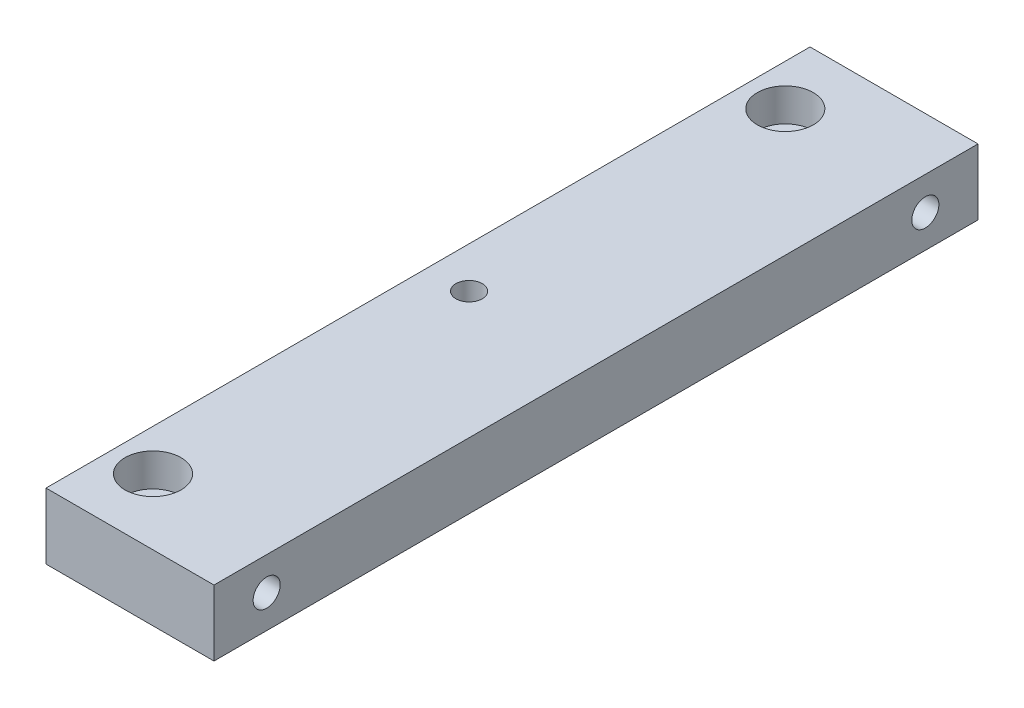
SolidWorks part; units mm, degrees
ref_plane "Front Plane" through (0, 0, 0) normal (0, 0, 1) x (1, 0, 0)
ref_plane "Top Plane" through (0, 0, 0) normal (0, 1, 0) x (1, 0, 0)
ref_plane "Right Plane" through (0, 0, 0) normal (1, 0, 0) x (0, 0, -1)
sketch "Sketch1" plane through (0, 0, 0) normal (0, 1, 0) x (1, 0, 0)
  line L1 (-20.2438, 92.075) -> (20.2438, 92.075)
  line L2 (-20.2438, 92.075) -> (-20.2438, -92.075)
  line L3 (-20.2438, -92.075) -> (20.2438, -92.075)
  line L4 (20.2438, 92.075) -> (20.2438, -92.075)
  line L5 (-20.2438, 92.075) -> (20.2438, -92.075) construction
  line L6 (-20.2438, -92.075) -> (20.2438, 92.075) construction
  point P0 (0, 0)
  dimension "D1" = 40.4876
  dimension "D2" = 184.15
extrude "Boss-Extrude1" add sketch "Sketch1" along normal mid plane 15.875
hole_wizard "CBORE for 1/4 Socket Head Cap Screw1" positions "Sketch2" profile "Sketch3" counterbore size "5/16" standard "ANSI Inch"
sketch "Sketch2" plane through (0, 7.9375, 0) normal (0, 1, 0) x (1, 0, 0)
  point P0 (-10.3235, -76.2)
  point P3 (-10.3235, 76.2)
sketch "Sketch3" plane through (-10.3235, 7.9375, 76.2) normal (1, 0, 0) x (0, 0, 1)
  line L0 (0, 0) -> (0, 15.875)
  line L1 (0, 15.875) -> (4.2164, 15.875)
  line L3 (4.2164, 15.875) -> (4.2164, 7.9375)
  line L4 (4.2164, 7.9375) -> (6.7475, 7.9375)
  line L5 (6.7475, 7.9375) -> (6.7475, 0)
  line L7 (6.7475, 0) -> (0, 0)
  line L11 (0, -6.35) -> (0, 107.95) construction
  dimension "Thru Hole Dia." = 8.4328
  dimension "Thru Hole Depth" = 15.875
  dimension "C'Bore Dia." = 13.495
  dimension "C'Bore Depth" = 7.9375
hole_wizard "1/4 (0.2500) Dowel Hole1" positions "Sketch4" profile "Sketch5" hole size "1/4" standard "ANSI Inch"
sketch "Sketch4" plane through (0, -7.9375, 0) normal (0, -1, 0) x (-1, 0, 0)
  point P0 (10.3362, 0)
sketch "Sketch5" plane through (-10.3362, -7.9375, 0) normal (1, 0, 0) x (0, 0, -1)
  line L0 (0, 0) -> (0, 15.875)
  line L1 (0, 15.875) -> (3.175, 15.875)
  line L2 (3.175, 15.875) -> (3.175, 0)
  line L5 (3.175, 0) -> (0, 0)
  line L11 (0, -6.35) -> (0, 107.95) construction
  dimension "Thru Hole Dia." = 6.35
  dimension "Thru Hole Depth" = 15.875
hole_wizard "5/16-18 Tapped Hole1" positions "Sketch6" profile "Sketch7" tap size "5/16-18" standard "ANSI Inch"
sketch "Sketch6" plane through (20.2438, 0, 0) normal (1, 0, 0) x (0, 0, -1)
  line L0 (0, -7.9375) -> (0, -18.6443) construction
  line L1 (-92.075, -7.9375) -> (92.075, -7.9375) construction
  line L3 (92.075, 0) -> (79.375, 0) construction
  line L4 (92.075, 7.9375) -> (92.075, -7.9375) construction
  point P0 (79.375, 0)
  point P9 (-79.375, 0)
  dimension "D1" = 12.7
sketch "Sketch7" plane through (20.2438, 0, -79.375) normal (0, 1, 0) x (0, 0, -1)
  line L0 (0, 0) -> (0, 22.2811)
  line L1 (0, 22.2811) -> (3.2639, 20.32)
  line L2 (3.2639, 20.32) -> (3.2639, 0)
  line L5 (3.2639, 0) -> (0, 0)
  line L10 (0, 22.2811) -> (-3.2639, 20.32) construction
  line L11 (0, -6.35) -> (0, 107.95) construction
  dimension "Tap Drill Dia." = 6.5278
  dimension "Tap Drill Depth" = 20.32
  dimension "Drill Angle" = 118
